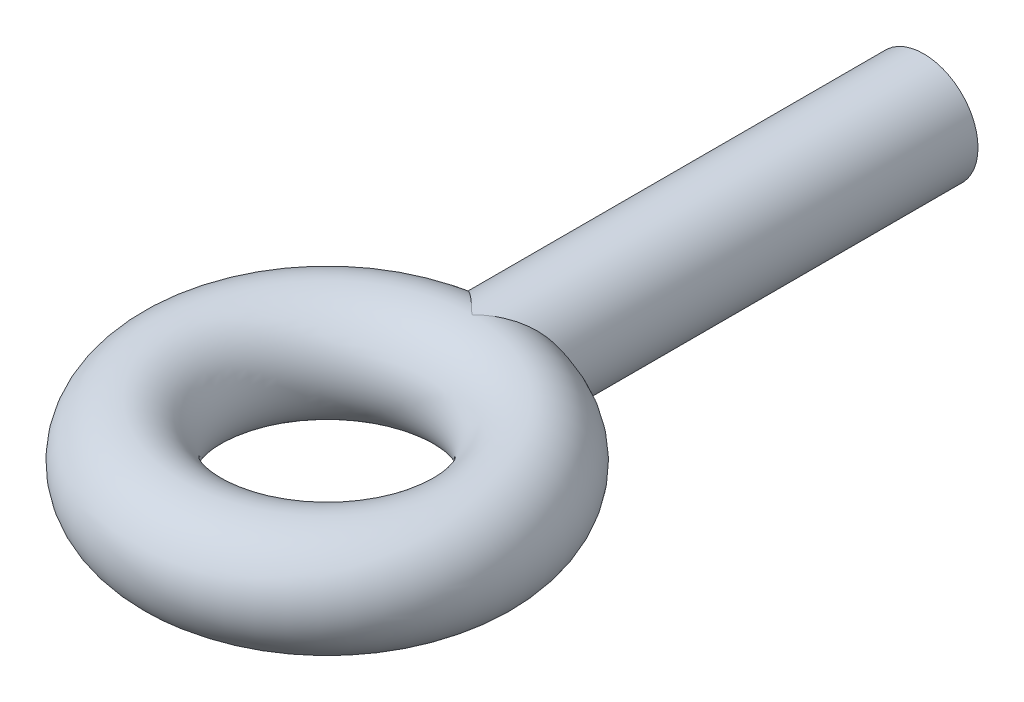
SolidWorks part; units mm, degrees
ref_plane "Front Plane" through (0, 0, 0) normal (0, 0, 1) x (1, 0, 0)
ref_plane "Top Plane" through (0, 0, 0) normal (0, 1, 0) x (1, 0, 0)
ref_plane "Right Plane" through (0, 0, 0) normal (1, 0, 0) x (0, 0, -1)
sketch "Sketch1" plane through (0, 0, 0) normal (0, 0, 1) x (1, 0, 0)
  circle A0 centre (0, 0) radius 6
  dimension "D1" = 12
extrude "Boss-Extrude1" add sketch "Sketch1" along normal blind 50
sketch "Sketch2" plane through (0, 0, 0) normal (1, 0, 0) x (0, 0, -1)
  line L0 (-50, 6) -> (-50, -6) construction
  line L1 (-66, 0) -> (-66, 22.4232) construction
  circle A0 centre (-50, 0) radius 6
  dimension "D1" = 16
revolve "Revolve1" add sketch "Sketch2" angle 360 about L1
